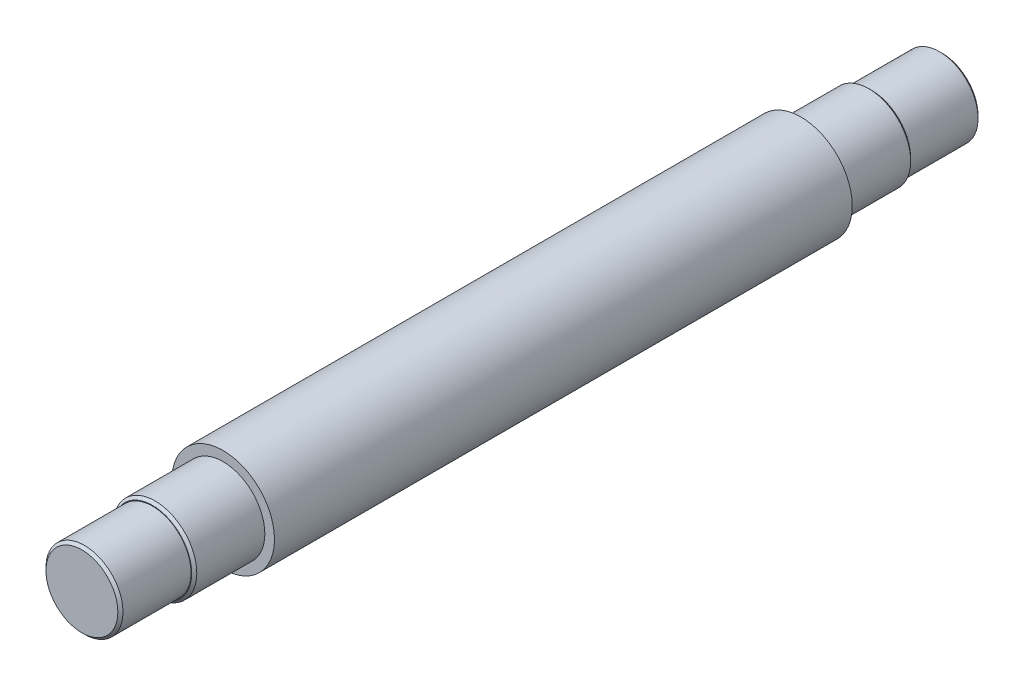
SolidWorks part; units mm, degrees
ref_plane "前视基准面" through (0, 0, 0) normal (0, 0, 1) x (1, 0, 0)
ref_plane "上视基准面" through (0, 0, 0) normal (0, 1, 0) x (1, 0, 0)
ref_plane "右视基准面" through (0, 0, 0) normal (1, 0, 0) x (0, 0, -1)
sketch "草图1" plane through (0, 0, 0) normal (0, 0, 1) x (1, 0, 0)
  circle A0 centre (0, 0) radius 40
extrude "凸台-拉伸1" add sketch "草图1" along normal blind 450
sketch "草图2" plane through (0, 0, 450) normal (0, 0, 1) x (1, 0, 0)
  circle A0 centre (0, 0) radius 32.5
extrude "凸台-拉伸2" add sketch "草图2" along normal blind 55
sketch "草图3" plane through (0, 0, 0) normal (0, 0, -1) x (-1, 0, 0)
  circle A0 centre (0, 0) radius 32.5
extrude "凸台-拉伸3" add sketch "草图3" along normal blind 55
sketch "草图4" plane through (0, 0, -55) normal (0, 0, -1) x (-1, 0, 0)
  circle A0 centre (0, 0) radius 30
extrude "凸台-拉伸4" add sketch "草图4" along normal blind 55
sketch "草图5" plane through (0, 0, 505) normal (0, 0, 1) x (1, 0, 0)
  circle A0 centre (0, 0) radius 30
extrude "凸台-拉伸5" add sketch "草图5" along normal blind 55
chamfer "倒角1" distance 2 angle 45 1 edges at (-32.5, 0, -55)
chamfer "倒角2" distance 2 angle 45 3 edges at (30, 0, 560) (32.5, 0, 505) (-30, 0, -110)
